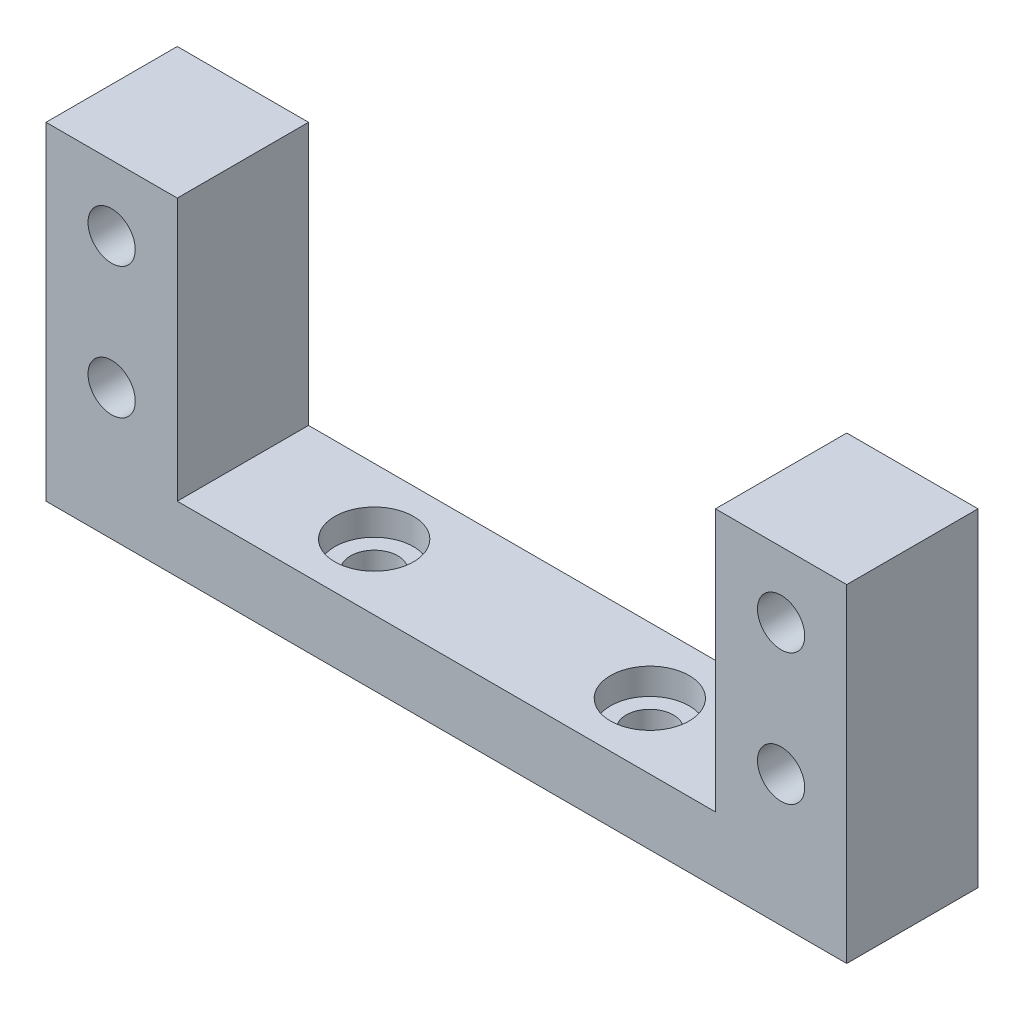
SolidWorks part; units mm, degrees
ref_plane "Plan de face" through (0, 0, 0) normal (0, 0, 1) x (1, 0, 0)
ref_plane "Plan de dessus" through (0, 0, 0) normal (0, 1, 0) x (1, 0, 0)
ref_plane "Plan de droite" through (0, 0, 0) normal (1, 0, 0) x (0, 0, -1)
sketch "Esquisse1" plane through (0, 0, 0) normal (0, 0, 1) x (1, 0, 0)
  line L0 (-10, 25) -> (0, 25)
  line L1 (-10, 25) -> (-10, 0)
  line L2 (0, 25) -> (0, 0)
  line L3 (-10, 0) -> (0, 0)
  line L4 (41, 25) -> (51, 25)
  line L5 (41, 25) -> (41, 0)
  line L6 (51, 25) -> (51, 0)
  line L7 (41, 0) -> (51, 0)
  line L8 (0, 0) -> (0, 5)
  line L9 (0, 0) -> (41, 0)
  line L10 (0, 5) -> (41, 5)
  line L11 (41, 0) -> (41, 5)
  circle A0 centre (46, 20) radius 1.8
  circle A1 centre (46, 10) radius 1.8
  circle A2 centre (-5, 20) radius 1.8
  circle A3 centre (-5, 10) radius 1.8
  dimension "D7" = 3.6
  dimension "D1" = 41
  dimension "D2" = 25
  dimension "D3" = 5
  dimension "D4" = 25
  dimension "D5" = 10
  dimension "D6" = 10
  dimension "D8" = 5
  dimension "D9" = 5
  dimension "D10" = 5
  dimension "D11" = 5
  dimension "D12" = 5
  dimension "D13" = 5
  dimension "D14" = 10
  dimension "D15" = 10
extrude "Boss.-Extru.1" add sketch "Esquisse1" along normal blind 10 contours L1 L3 L2 L0 A3 A2 | L10 L2 L9 L5 | L5 L7 L6 L4 A1 A0
sketch "Esquisse2" plane through (0, 0, 0) normal (0, -1, 0) x (1, 0, 0)
  line L0 (41, 10) -> (41, 0) construction
  line L1 (0, 10) -> (0, 0) construction
  line L2 (-10, 0) -> (51, 0) construction
  circle A0 centre (10, 5) radius 1.8
  circle A1 centre (31, 5) radius 1.8
  dimension "D1" = 3.6
  dimension "D2" = 3.6
  dimension "D3" = 10
  dimension "D4" = 10
  dimension "D5" = 5
  dimension "D6" = 5
extrude "Enlèv. mat.-Extru.1" cut sketch "Esquisse2" against normal blind 10
sketch "Esquisse3" plane through (0, 5, 0) normal (0, 1, 0) x (1, 0, 0)
  circle A0 centre (10, -5) radius 3
  circle A1 centre (31, -5) radius 3
  dimension "D1" = 6
  dimension "D2" = 6
extrude "Enlèv. mat.-Extru.2" cut sketch "Esquisse3" against normal blind 2
